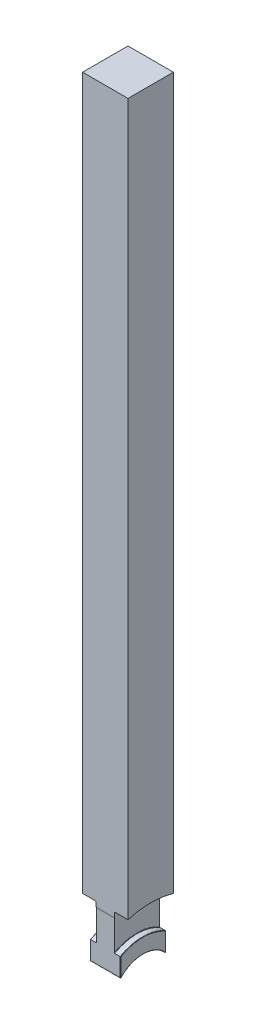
SolidWorks part; units mm, degrees
other "<6-40 DETENT>-<Imported2>"
other "<6-40 DETENT>-<Imported1>"
ref_plane "Front Plane" through (0, 0, 0) normal (0, 0, 1) x (1, 0, 0)
ref_plane "Top Plane" through (0, 0, 0) normal (0, 1, 0) x (1, 0, 0)
ref_plane "Right Plane" through (0, 0, 0) normal (1, 0, 0) x (0, 0, -1)
sketch "Sketch1" plane through (0, 0, 0) normal (1, 0, 0) x (0, 0, -1)
  line L0 (-7.5, 260) -> (-7.5, 0)
  line L1 (0, 249.2329) -> (0, 0) construction
  line L2 (7.5, 260) -> (7.5, 0)
  line L3 (-7.5, 260) -> (7.5, 260)
  line L4 (-7.5, 0) -> (7.5, 0)
  circle A1 centre (0, 0) radius 10 construction
  point P5 (0, 9.5428)
  dimension "D1" = 10
  dimension "D2" = 250
  dimension "D3" = 15
  dimension "D4" = 0.4572
extrude "Boss-Extrude1" add sketch "Sketch1" along normal mid plane 15
sketch "Sketch2" plane through (0, 0, 0) normal (0, 0, 1) x (1, 0, 0)
  line L0 (7.5, 15) -> (3, 15)
  line L1 (7.5, 260) -> (7.5, 0) construction
  line L2 (3, 15) -> (3, 26)
  line L3 (3, 26) -> (7.5, 26)
  line L4 (7.5, 26) -> (7.5, 15)
  line L5 (0, 29.9173) -> (0, 0) construction
  line L6 (-7.5, 26) -> (-7.5, 15)
  line L7 (-3, 26) -> (-7.5, 26)
  line L8 (-3, 15) -> (-3, 26)
  line L9 (-7.5, 15) -> (-3, 15)
  line L10 (-8.8482, 0) -> (24.5305, 0) construction
  dimension "D1" = 6
  dimension "D2" = 26
  dimension "D3" = 15
revolve "Cut-Revolve1" cut sketch "Sketch2" angle 360 about L10
sketch "Sketch6" plane through (0, 0, 0) normal (1, 0, 0) x (0, 0, -1)
  line L0 (0, 19.903) -> (0, 3.2785) construction
  line L1 (7.475, 0) -> (22.715, 0)
  line L2 (7.475, 0) -> (7.475, 23)
  line L3 (9.475, 25) -> (22.715, 25)
  line L4 (22.715, 0) -> (22.715, 25)
  line L9 (-7.475, 0) -> (-22.715, 0)
  line L10 (-22.715, 0) -> (-22.715, 25)
  line L11 (-9.475, 25) -> (-22.715, 25)
  line L12 (-7.475, 0) -> (-7.475, 23)
  line L13 (-7.5, 0) -> (7.5, 0) construction
  line L14 (-7.5, 22.1375) -> (-7.5, 25) construction
  line L15 (-7.5, 260) -> (-7.5, 24.8948) construction
  arc A0 (7.475, 23) -> (9.475, 25) centre (9.475, 23) cw
  arc A1 (-7.475, 23) -> (-9.475, 25) centre (-9.475, 23) ccw
  dimension "D3" = 2
  dimension "D1" = 14.95
  dimension "D2" = 15.24
  dimension "D4" = 25
extrude "Cut-Extrude2" cut sketch "Sketch6" against normal through all both and the other way through all
sketch "Sketch7" plane through (0, 0, 0) normal (1, 0, 0) x (0, 0, -1)
  circle A0 centre (0, 0) radius 10
  dimension "D1" = 10
extrude "Cut-Extrude3" cut sketch "Sketch7" against normal through all both and the other way through all
sketch "Sketch8" plane through (0, 0, 0) normal (0, 0, 1) x (1, 0, 0)
  line L1 (-7.5, 15) -> (-5, 15)
  line L2 (-7.5, 15) -> (-7.5, 6.6426)
  line L3 (-7.5, 6.6426) -> (-5, 6.6426)
  line L4 (-5, 15) -> (-5, 6.6426)
  line L5 (0, 18.3159) -> (0, 0) construction
  line L6 (5, 15) -> (5, 6.6426)
  line L7 (7.5, 6.6426) -> (5, 6.6426)
  line L8 (7.5, 15) -> (7.5, 6.6426)
  line L9 (7.5, 15) -> (5, 15)
  line L10 (-7.5, 6.6426) -> (7.5, 6.6426) construction
  dimension "D1" = 10
extrude "Cut-Extrude4" cut sketch "Sketch8" against normal through all both and the other way through all
fillet "Fillet1" radius 0.5 2 edges at (-3, 26, 0) (3, 26, 0)
fillet "Fillet2" radius 0.127 2 edges at (-3, 15, 0) (3, 15, 0)
hole_wizard "#6-40 Tapped Hole1" positions "Sketch3" profile "Sketch4" tap size "#6-40" standard "ANSI Inch"
sketch "Sketch3" plane through (0, 0, 0) normal (0, 1, 0) x (1, 0, 0)
  point P0 (0, 0)
sketch "Sketch4" plane through (0, 0, 0) normal (1, 0, 0) x (0, 0, -1)
  line L0 (0, 0) -> (0, 20.8623)
  line L1 (0, 20.8623) -> (1.4351, 20)
  line L2 (1.4351, 20) -> (1.4351, 0)
  line L5 (1.4351, 0) -> (0, 0)
  line L10 (0, 20.8623) -> (-1.4351, 20) construction
  line L11 (0, -6.35) -> (0, 107.95) construction
  dimension "Tap Drill Dia." = 2.8702
  dimension "Tap Drill Depth" = 20
  dimension "Drill Angle" = 118
fillet "Fillet3" radius 0.127 10 edges at (0, 6.6426, -7.475) (-5, 10, 0) (5, 10, 0) (0, 6.6426, 7.475) (-5, 9.8237, 7.475) (-5, 15, 0) (-5, 9.8237, -7.475) (5, 9.8237, -7.475) (5, 15, 0) (5, 9.8237, 7.475)
ref_plane "Detent Plane" through (0, 9.5428, 0) normal (0, 1, 0) x (1, 0, 0)
inserted part "6-40 DETENT"
move or copy body "Body-Move/Copy2" placed by mates yes
